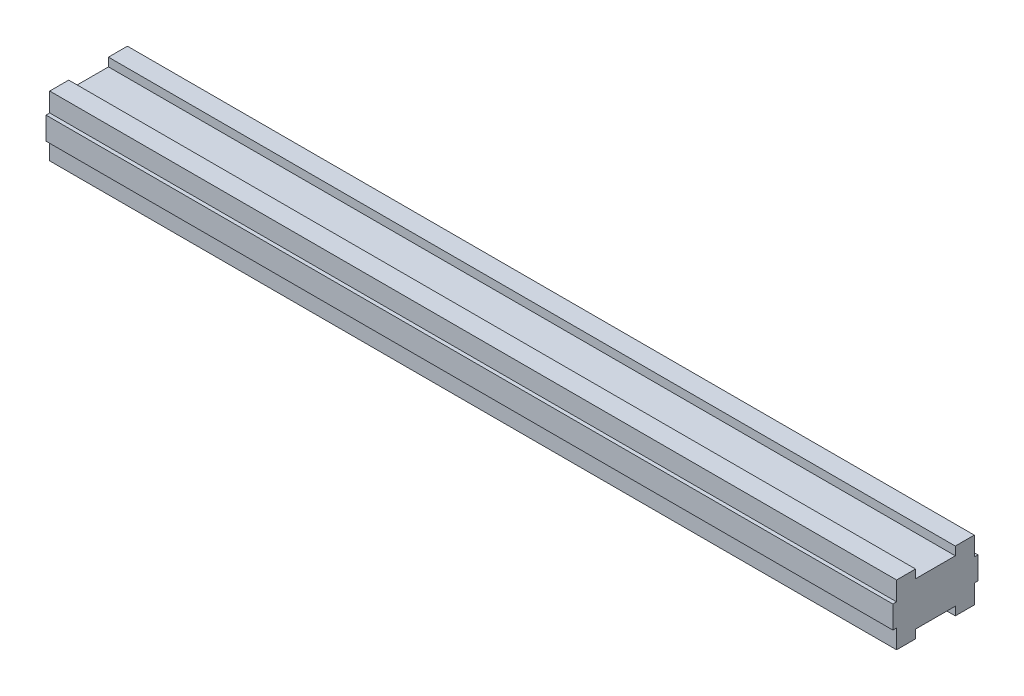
SolidWorks part; units mm, degrees
ref_plane "Plan de face" through (0, 0, 0) normal (0, 0, 1) x (1, 0, 0)
ref_plane "Plan de dessus" through (0, 0, 0) normal (0, 1, 0) x (1, 0, 0)
ref_plane "Plan de droite" through (0, 0, 0) normal (1, 0, 0) x (0, 0, -1)
sketch "Esquisse1" plane through (0, 0, 0) normal (0, 0, 1) x (1, 0, 0)
  line L0 (0, 0) -> (165.1, 0)
  dimension "D1" = 165.1
other "Elément mécano-soudé1"
ref_plane "Plan1" through (0, 0, 0) normal (1, 0, 0) x (0, 0, -1)
sketch "Sketch1" plane through (0, 0, 0) normal (1, 0, 0) x (0, 0, -1)
  line L0 (0.725, 3.7) -> (0.725, 0)
  line L1 (0.725, 11.8) -> (0.725, 8.1)
  line L2 (4.425, 11.8) -> (4.425, 10.15)
  line L3 (12.175, 11.8) -> (12.175, 10.15)
  line L4 (15.875, 11.8) -> (15.875, 8.1)
  line L5 (4.425, 1.65) -> (4.425, 0)
  line L6 (4.425, 1.65) -> (12.175, 1.65)
  line L7 (0, 8.1) -> (0, 3.7)
  line L8 (0.725, 3.7) -> (0, 3.7)
  line L9 (0.725, 8.1) -> (0, 8.1)
  line L10 (4.425, 0) -> (0.725, 0)
  line L11 (12.175, 0) -> (15.875, 0)
  line L12 (15.875, 8.1) -> (16.6, 8.1)
  line L13 (15.875, 3.7) -> (16.6, 3.7)
  line L14 (16.6, 8.1) -> (16.6, 3.7)
  line L15 (4.425, 10.15) -> (12.175, 10.15)
  line L16 (4.425, 11.8) -> (0.725, 11.8)
  line L17 (12.175, 11.8) -> (15.875, 11.8)
  line L18 (12.175, 1.65) -> (12.175, 0)
  line L19 (15.875, 3.7) -> (15.875, 0)
  line L20 (0, 5.9) -> (16.6, 5.9) construction
  line L21 (8.3, 10.15) -> (8.3, 1.65) construction
  point P2 (0, 0)
  point P25 (8.3, 5.9)
